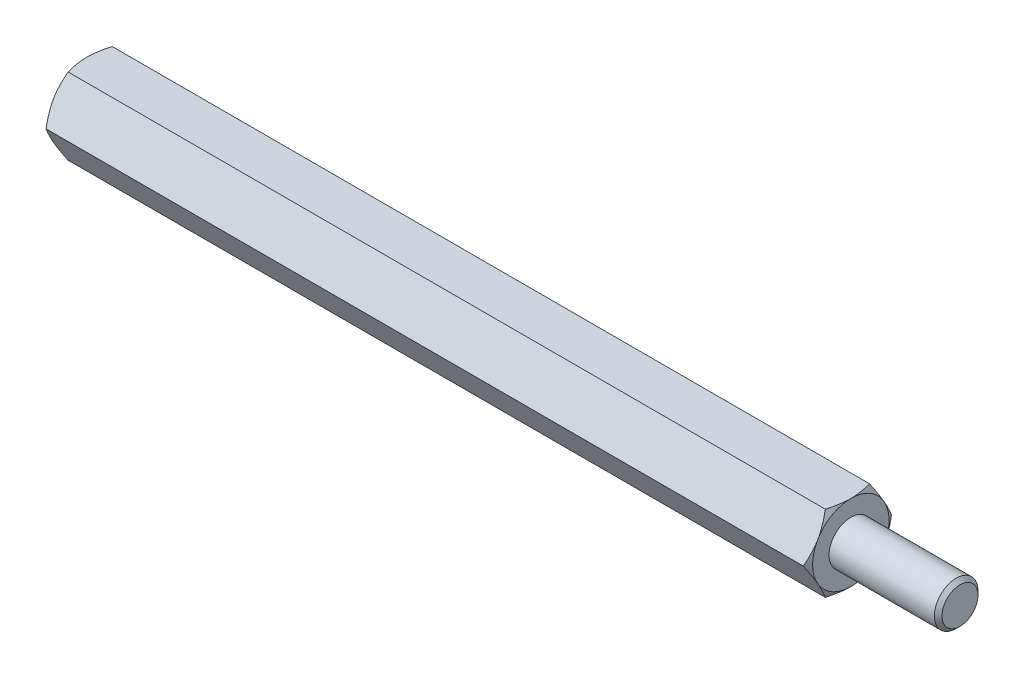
SolidWorks part; units mm, degrees
ref_plane "Front Plane" through (0, 0, 0) normal (0, 0, 1) x (1, 0, 0)
ref_plane "Top Plane" through (0, 0, 0) normal (0, 1, 0) x (1, 0, 0)
ref_plane "Right Plane" through (0, 0, 0) normal (1, 0, 0) x (0, 0, -1)
sketch "Sketch1" plane through (0, 0, 0) normal (1, 0, 0) x (0, 0, -1)
  line L1 (2.0207, 3.5) -> (-2.0207, 3.5)
  line L2 (-2.0207, 3.5) -> (-4.0415, 0)
  line L3 (-4.0415, 0) -> (-2.0207, -3.5)
  line L4 (-2.0207, -3.5) -> (2.0207, -3.5)
  line L5 (2.0207, -3.5) -> (4.0415, 0)
  line L6 (4.0415, 0) -> (2.0207, 3.5)
  circle A0 centre (0, 0) radius 3.5 construction
  dimension "D1" = 7
extrude "Extrude2" add sketch "Sketch1" along normal mid plane 70
sketch "Sketch2" plane through (0, 0, 0) normal (0, 0, 1) x (1, 0, 0)
  line L0 (-35, 3.5) -> (-33.5, 6.0981)
  line L1 (-35, 6.5) -> (-35, 3.5)
  line L3 (0, 0) -> (50000, 0) construction
  arc A0 (-33.5, 6.0981) -> (-35, 6.5) centre (-34.1962, 6.5) ccw
  dimension "D1" = 30
  dimension "D2" = 3
revolve "Cut-Revolve1" cut sketch "Sketch2" angle 360 about L3
mirror "Mirror1" about plane through (0, 0, 0) normal (1, 0, 0) of "Cut-Revolve1"
sketch "Sketch3" plane through (-35, 0, 0) normal (-1, 0, 0) x (0, 0, 1)
  circle A0 centre (0, 0) radius 1.65
  dimension "D1" = 3.3
extrude "Extrude3" cut sketch "Sketch3" against normal blind 10
sketch "Sketch4" plane through (0, 0, 0) normal (0, 0, 1) x (1, 0, 0)
  line L0 (-25, 0) -> (-25, 1.65)
  line L1 (34.6874, 0) -> (-34.6874, 0) construction
  line L2 (-25, 1.65) -> (-24.0474, 0)
  line L3 (-24.0474, 0) -> (-25, 0)
  line L4 (-35, 1.75) -> (-35, -1.75) construction
  point P4 (-35, 0)
  dimension "D1" = 30
  dimension "D2" = 1.65
  dimension "D3" = 10
revolve "Cut-Revolve2" cut sketch "Sketch4" angle 360 about L3
sketch "Sketch5" plane through (35, 0, 0) normal (1, 0, 0) x (0, 0, -1)
  circle A0 centre (0, 0) radius 2
  dimension "D1" = 4
extrude "Extrude4" add sketch "Sketch5" along normal blind 10
chamfer "Chamfer1" distance 0.35 angle 45 1 edges at (45, 0, -2)
equation "\"D2@Sketch4\" = \"D1@Sketch3\"/2"
